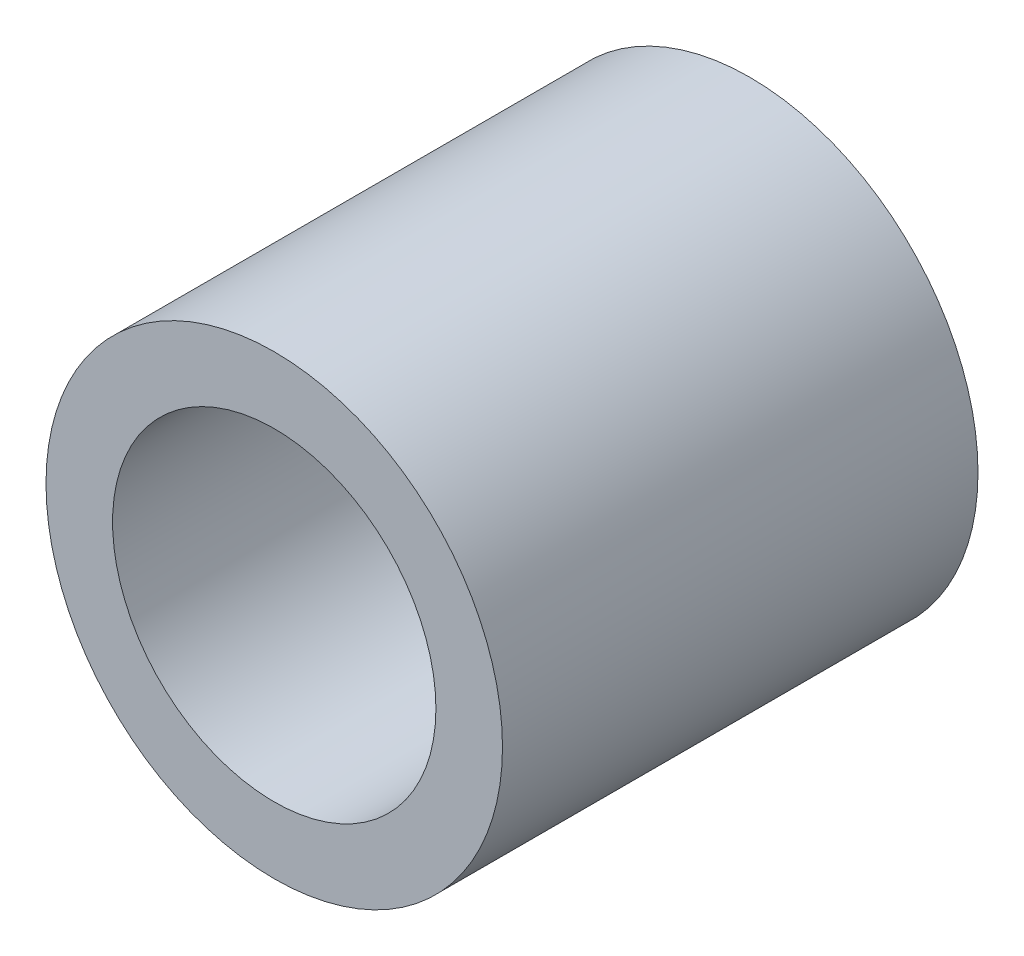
SolidWorks part; units mm, degrees
ref_plane "Plan de face" through (0, 0, 0) normal (0, 0, 1) x (1, 0, 0)
ref_plane "Plan de dessus" through (0, 0, 0) normal (0, 1, 0) x (1, 0, 0)
ref_plane "Plan de droite" through (0, 0, 0) normal (1, 0, 0) x (0, 0, -1)
sketch "Esquisse1" plane through (0, 0, 0) normal (0, 0, 1) x (1, 0, 0)
  circle A0 centre (0, 0) radius 8.5
  circle A1 centre (0, 0) radius 12
  dimension "D2" = 24
  dimension "D1" = 17
extrude "Extrusion1" add sketch "Esquisse1" along normal mid plane 25
